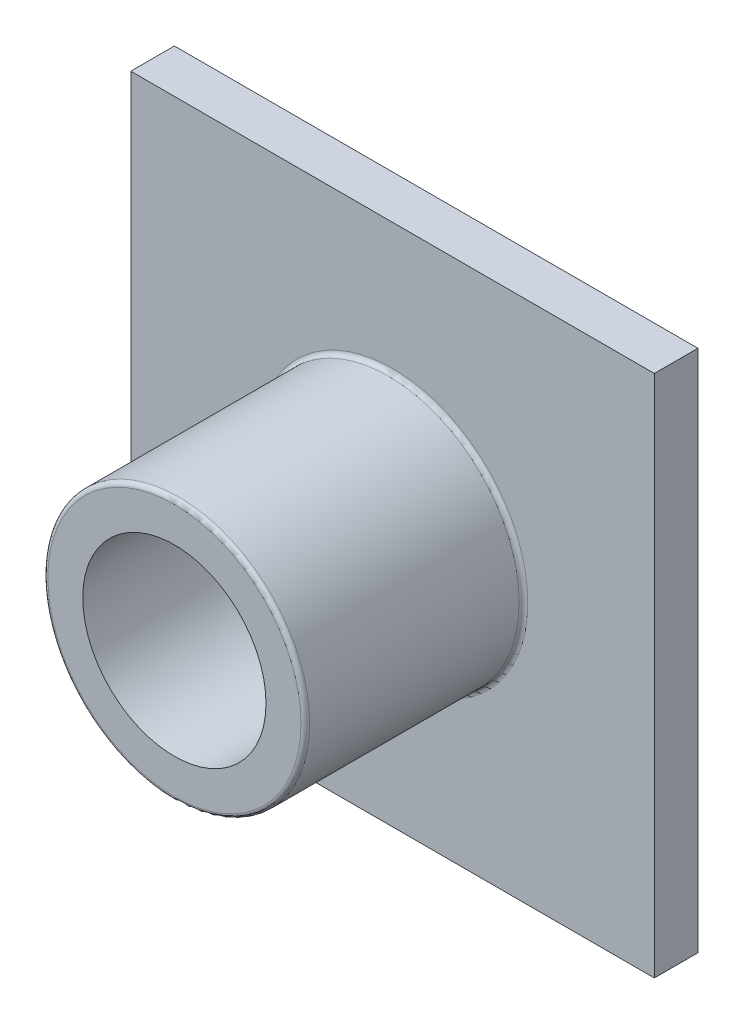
SolidWorks part; units mm, degrees
ref_plane "Face" through (0, 0, 0) normal (0, 0, 1) x (1, 0, 0)
ref_plane "Dessus" through (0, 0, 0) normal (0, 1, 0) x (1, 0, 0)
ref_plane "Droite" through (0, 0, 0) normal (1, 0, 0) x (0, 0, -1)
sketch "Esquisse1" plane through (0, 0, 0) normal (0, 0, 1) x (1, 0, 0)
  line L0 (-6, -6) -> (6, 6) construction
  line L1 (-6, 6) -> (6, 6)
  line L2 (-6, 6) -> (-6, -6)
  line L3 (-6, -6) -> (6, -6)
  line L4 (6, 6) -> (6, -6)
  dimension "D1" = 12
extrude "Extrusion1" add sketch "Esquisse1" along normal blind 1
sketch "Esquisse2" plane through (0, 0, 1) normal (0, 0, 1) x (1, 0, 0)
  circle A0 centre (0, 0) radius 3
  dimension "D1" = 6
extrude "Extrusion2" add sketch "Esquisse2" along normal blind 5
sketch "Esquisse3" plane through (0, 0, 6) normal (0, 0, 1) x (1, 0, 0)
  circle A0 centre (0, 0) radius 2.1
  dimension "D1" = 4.2
extrude "Extrusion3" cut sketch "Esquisse3" against normal through all
fillet "Congé1" radius 0.6 1 edges at (2.1, 0, 0)
fillet "Congé2" radius 0.1 2 edges at (3, 0, 1) (3, 0, 6)
